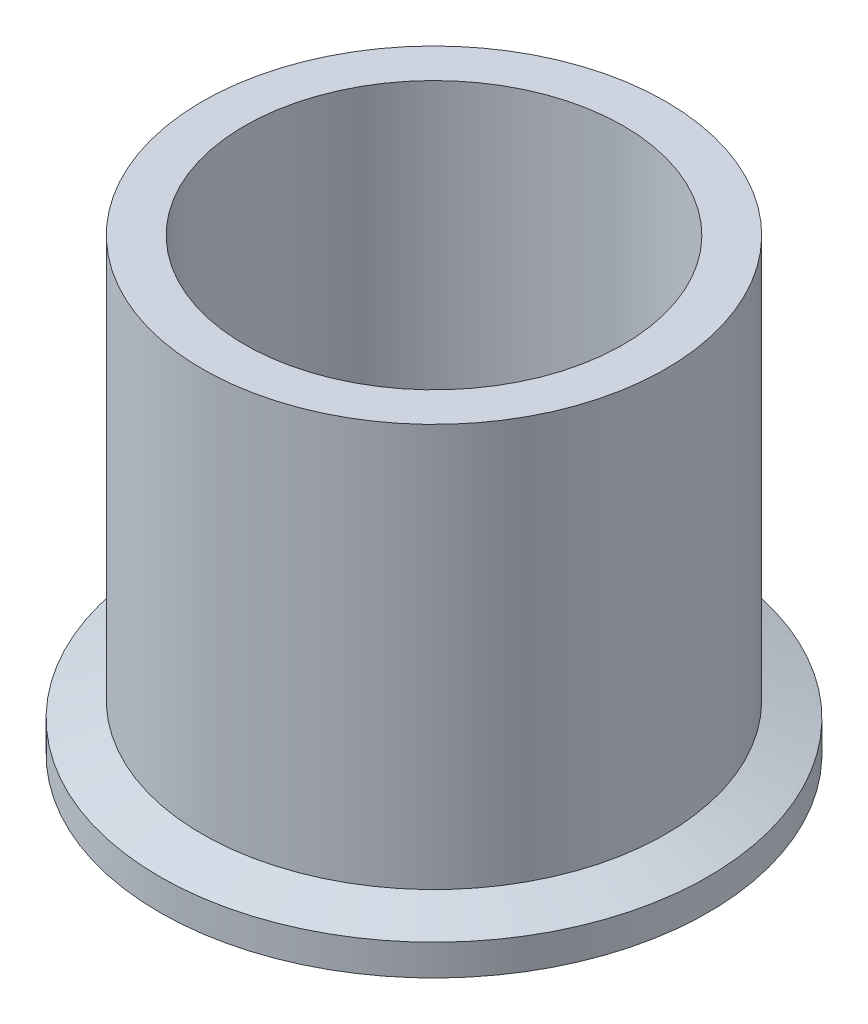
SolidWorks part; units mm, degrees
ref_plane "Front Plane" through (0, 0, 0) normal (0, 0, 1) x (1, 0, 0)
ref_plane "Top Plane" through (0, 0, 0) normal (0, 1, 0) x (1, 0, 0)
ref_plane "Right Plane" through (0, 0, 0) normal (1, 0, 0) x (0, 0, -1)
sketch "Sketch1" plane through (0, 0, 0) normal (0, 0, 1) x (1, 0, 0)
  line L0 (0, 0) -> (0, 41.275) construction
  line L1 (0, 41.275) -> (-21.2852, 41.275)
  line L2 (-21.2852, 41.275) -> (-21.2852, 4.2685)
  line L3 (-21.2852, 4.2685) -> (-25.1968, 2.8448)
  line L4 (-25.1968, 2.8448) -> (-25.1968, 0)
  line L5 (-25.1968, 0) -> (-23.6366, 0)
  line L6 (-20.0006, 0) -> (0, 0)
  line L7 (0, 0) -> (0, 41.275)
  line L8 (0, 41.275) -> (-17.399, 41.275)
  line L9 (-17.399, 41.275) -> (-17.399, 0)
  line L10 (-17.399, 0) -> (0, 0)
  line L11 (0, 0) -> (-0.1846, 0.0129)
  arc A0 (-22.9141, 0.4745) -> (-20.7231, 0.4745) centre (-21.8186, 0) cw
  arc A1 (-20.0006, 0) -> (-20.7231, 0.4745) centre (-20.0006, 0.7874) cw
  arc A2 (-22.9141, 0.4745) -> (-23.6366, 0) centre (-23.6366, 0.7874) cw
  point P12 (-20.6248, 0)
  dimension "D6" = 1.1938
  dimension "D7" = 0.7874
  dimension "D1" = 17.399
  dimension "D2" = 2.8448
  dimension "D3" = 25.1968
  dimension "D4" = 70
  dimension "D5" = 21.8186
  dimension "D8" = 3.8862
  dimension "D9" = 41.275
revolve "Revolve2" add sketch "Sketch1" angle 360 about L0
